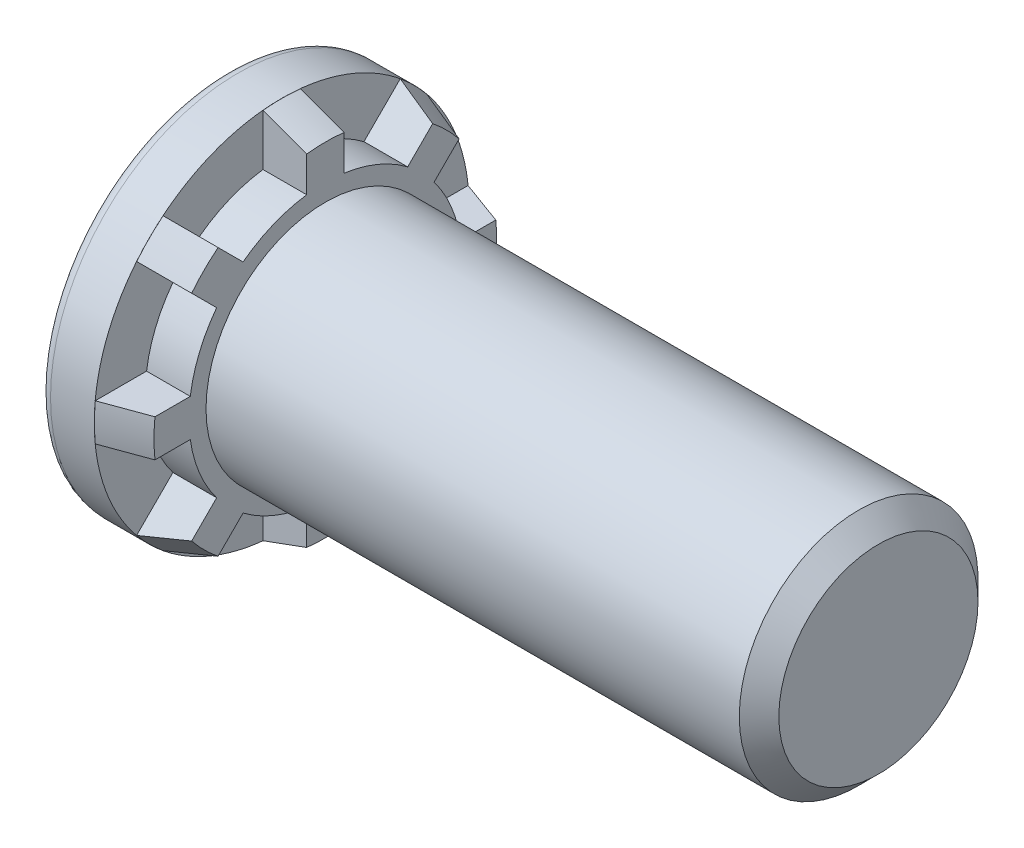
SolidWorks part; units mm, degrees
ref_plane "Plane1" through (0, 0, 0) normal (0, 0, 1) x (1, 0, 0)
ref_plane "Plane2" through (0, 0, 0) normal (0, 1, 0) x (1, 0, 0)
ref_plane "Plane3" through (0, 0, 0) normal (1, 0, 0) x (0, 0, -1)
sketch "BodySke" plane through (0, 0, 0) normal (0, 0, 1) x (1, 0, 0)
  line L0 (-2.29, 7.392) -> (-2.29, 0)
  line L1 (1.832, 7.1816) -> (1.832, 5)
  line L2 (0.0025, 7.8475) -> (1.832, 7.1816)
  line L3 (1.832, 5) -> (24.172, 5)
  line L4 (25, 4.172) -> (25, 0)
  line L5 (25, 0) -> (-2.29, 0)
  line L6 (0, 0) -> (50.554, 0) construction
  line L8 (25, 4.172) -> (24.172, 5)
  line L9 (-1.832, 7.85) -> (0, 7.85)
  line L10 (0.0025, 7.8475) -> (0, 7.8475)
  line L11 (1.5, 19.05) -> (1.5, -3.175) construction
  line L12 (0, 7.8475) -> (0, 7.85)
  arc A0 (-2.29, 7.392) -> (-1.832, 7.85) centre (-1.832, 7.392) cw
  dimension "D2" = 0.0025
  dimension "Fillet_rad" = 0.458
  dimension "D1" = 20
  dimension "Diameter" = 10
  dimension "D3" = 0.0025
  dimension "Length" = 25
  dimension "Body_ch_ang" = 45
  dimension "Minor_dia" = 8.344
  dimension "Advance" = 1.5
  dimension "H_dia" = 15.7
  dimension "T_dim" = 2.29
  dimension "Clinch_ht" = 1.832
revolve "BaseBody" add sketch "BodySke" angle 360 about L6
sketch "ThdSchSke" plane through (0, 0, 0) normal (0, 0, 1) x (1, 0, 0)
  line L0 (4.1, -4.172) -> (3.5202, -5)
  line L1 (4.1, -4.172) -> (4.6798, -5)
  line L2 (4.6798, -5) -> (4.6798, -6.25)
  line L3 (-3.175, 0) -> (5.1513, 0) construction
  line L4 (0, -7.85) -> (0, 7.85) construction
  line L5 (4.6798, -6.25) -> (3.5202, -6.25)
  line L6 (3.5202, -6.25) -> (3.5202, -5)
  dimension "Thread_minor" = 8.344
  dimension "Diameter" = 10
  dimension "Start" = 4.1
  dimension "SideAngle" = 55
  dimension "VeeAngle" = 70
  dimension "Overcut" = 12.5
revolve "ThreadSchematic" [suppressed] cut sketch "ThdSchSke" angle 360 about L3
pattern_linear "ThdSchPat" [suppressed]
sketch "RibCutSke" plane through (1.832, 1.7944, -0.091) normal (1, 0, 0) x (0, 0, -1)
  line L0 (0.6912, 3.8643) -> (0.6912, 6.0165)
  line L1 (3.3573, 2.76) -> (4.8791, 4.2818)
  line L2 (0.6912, 3.144) -> (0.6912, 2.4006) construction
  line L3 (-0.091, -1.7944) -> (-0.091, 5.0239) construction
  line L4 (-0.091, -1.7944) -> (0.6912, 3.144) construction
  line L5 (-0.091, -1.7944) -> (2.848, 2.2507) construction
  line L6 (2.848, 2.2507) -> (2.3273, 1.73) construction
  arc A1 (3.3573, 2.76) -> (0.6912, 3.8643) centre (-0.091, -1.7944) ccw
  arc A2 (4.8791, 4.2818) -> (0.6912, 6.0165) centre (-0.091, -1.7944) ccw
  circle A3 centre (-0.091, -1.7944) radius 7.1816 construction
  circle A4 centre (-0.091, -1.7944) radius 5 construction
  dimension "Inner_dia" = 11.425
  dimension "Outer_dia" = 15.7
  dimension "Rib_root_dia" = 10
  dimension "Rib_root_half_angle" = 9
  dimension "Rib_root_gap_angle" = 27
  dimension "Angle" = 45
extrude "RibCut" cut sketch "RibCutSke" against normal blind 1.832
pattern_circular "RibCutsPat" count 8 every 45 about axis through (0, 0, 0) along (1, 0, 0) of "RibCut"
equation "' \"Length@BodySke\" = 25"
equation "' \"H_dia@BodySke\" = 15.7"
equation "' \"Start@ThdSchSke\" = 4.1"
equation "' \"T_dim@BodySke\" = 2.29"
equation "' \"Diameter@BodySke\" = 10"
equation "' \"Minor_dia@BodySke\" = 8.344"
equation "' \"Advance@BodySke\" = 1.5"
equation "\"Fillet_rad@BodySke\" =  \"T_dim@BodySke\" * 0.2"
equation "\"Clinch_ht@BodySke\" = \"T_dim@BodySke\" * 0.8"
equation "\"Num_ribs@RibCutsPat\" = 8"
equation "\"Angle@RibCutSke\" =\"Angle@RibCutsPat\""
equation "\"Rib_root_half_angle@RibCutSke\" = \"Angle@RibCutSke\" / 5"
equation "\"Rib_root_gap_angle@RibCutSke\" = \"Angle@RibCutSke\" - (2 * \"Rib_root_half_angle@RibCutSke\" )"
equation "\"Rib_root_dia@RibCutSke\" = \"Diameter@BodySke\""
equation "\"Inner_dia@RibCutSke\" = \"Diameter@BodySke\" + ( \"H_dia@BodySke\" - \"Diameter@BodySke\" ) / 4"
equation "\"Outer_dia@RibCutSke\" = \"H_dia@BodySke\""
equation "\"Depth@RibCut\" = \"Clinch_ht@BodySke\""
equation "\"Thread_length@ThreadCosmetic\" = \"Length@BodySke\" - \"Start@ThdSchSke\""
equation "\"Thread_minor@ThreadCosmetic\" = \"Minor_dia@BodySke\""
equation "\"Thread_minor@ThdSchSke\" = \"Minor_dia@BodySke\""
equation "\"Diameter@ThdSchSke\" = \"Diameter@BodySke\""
equation "\"Overcut@ThdSchSke\" = \"Diameter@BodySke\" * 1.25"
equation "\"Num_threads@ThdSchPat\" = int( \"Thread_length@ThreadCosmetic\" / \"Advance@BodySke\" + 0.999 )  + 1"
equation "\"Advance@ThdSchPat\" = \"Thread_length@ThreadCosmetic\" /  (\"Num_threads@ThdSchPat\" - 1) 'relax it"
equation "\"Num_threads@ThdSchPat\" = \"Num_threads@ThdSchPat\" - sgn( \"Num_threads@ThdSchPat\" - 1) '---chamfered tips only---"
